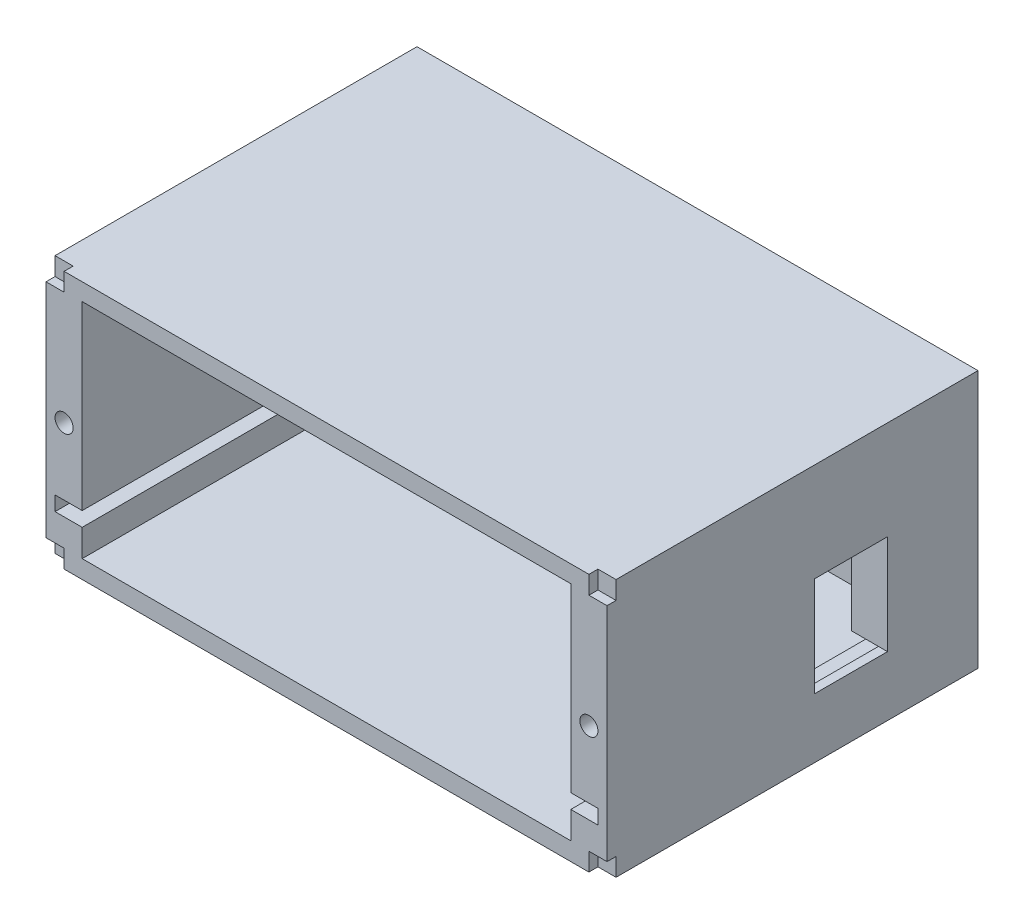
SolidWorks part; units mm, degrees
ref_plane "Front Plane" through (0, 0, 0) normal (0, 0, 1) x (1, 0, 0)
ref_plane "Top Plane" through (0, 0, 0) normal (0, 1, 0) x (1, 0, 0)
ref_plane "Right Plane" through (0, 0, 0) normal (1, 0, 0) x (0, 0, -1)
sketch "Sketch1" plane through (0, 0, 0) normal (0, 0, 1) x (1, 0, 0)
  line L0 (0, 52.9432) -> (0, -40.5494) construction
  line L1 (-31, 0) -> (31, 0)
  line L2 (31, 0) -> (31, 28.5)
  line L3 (31, 28.5) -> (-31, 28.5)
  line L4 (-31, 0) -> (-31, 28.5)
  point P8 (0, 28.5)
  point P9 (0, 0)
extrude "Extrude1" add sketch "Sketch1" against normal blind 41
sketch "Sketch2" plane through (0, 0, 0) normal (0, 0, 1) x (1, 0, 0)
  line L0 (0, 0) -> (0, 28.5) construction
  line L1 (31, 28.5) -> (-31, 28.5) construction
  line L2 (0, 0) -> (0, 2)
  line L3 (-27, 2) -> (27, 2)
  line L4 (27, 2) -> (27, 5)
  line L5 (27, 5) -> (30, 5)
  line L6 (30, 5) -> (30, 6.6)
  line L7 (30, 6.6) -> (27, 6.6)
  line L8 (27, 6.6) -> (27, 26.6)
  line L9 (27, 26.6) -> (-27, 26.6)
  line L10 (-30, 5) -> (-30, 6.6)
  line L11 (-27, 6.6) -> (-27, 26.6)
  line L12 (-30, 6.6) -> (-27, 6.6)
  line L13 (-27, 5) -> (-30, 5)
  line L14 (-27, 2) -> (-27, 5)
  point P17 (0, 26.6)
extrude "Cut-Extrude1" cut sketch "Sketch2" against normal blind 40
sketch "Sketch3" plane through (0, 0, 0) normal (0, 0, 1) x (1, 0, 0)
  circle A0 centre (-29, 14) radius 1
  circle A1 centre (29, 14) radius 1
extrude "Cut-Extrude2" cut sketch "Sketch3" against normal blind 10
sketch "Sketch4" plane through (0, 0, 0) normal (0, 0, 1) x (1, 0, 0)
  line L1 (-31, 28.5) -> (-29, 28.5)
  line L2 (-31, 28.5) -> (-31, 26.5)
  line L3 (-31, 26.5) -> (-29, 26.5)
  line L4 (-29, 28.5) -> (-29, 26.5)
  line L5 (-31, 0) -> (-29, 0)
  line L6 (-31, 0) -> (-31, 2)
  line L7 (-31, 2) -> (-29, 2)
  line L8 (-29, 0) -> (-29, 2)
  line L9 (31, 0) -> (29, 0)
  line L10 (31, 0) -> (31, 2)
  line L11 (31, 2) -> (29, 2)
  line L12 (29, 0) -> (29, 2)
  line L13 (31, 28.5) -> (29, 28.5)
  line L14 (31, 28.5) -> (31, 26.5)
  line L15 (31, 26.5) -> (29, 26.5)
  line L16 (29, 28.5) -> (29, 26.5)
extrude "Cut-Extrude3" cut sketch "Sketch4" against normal blind 1
sketch "Sketch6" plane through (31, 0, 0) normal (1, 0, 0) x (0, 0, -1)
  line L0 (41, 0) -> (41, 6.6)
  line L1 (41, 0) -> (1, 0) construction
  line L2 (41, 0) -> (41, 28.5) construction
  line L4 (31, 6.6) -> (31, 12.6)
  line L5 (31, 12.6) -> (22.9381, 12.6)
  line L6 (22.9381, 12.6) -> (22.9381, 6.6)
  line L7 (22.9381, 6.6) -> (31, 6.6)
extrude "Cut-Extrude5" cut sketch "Sketch6" against normal blind 5.5
chamfer "Chamfer2" distance 5 angle 45 1 edges at (31, 12.6, -26.9691)
sketch "Sketch7" plane through (0, 0, 0) normal (0, -1, 0) x (1, 0, 0)
  line L0 (0, -40.4625) -> (0, 0) construction
  line L1 (0, -20.2312) -> (-31, -20.2312) construction
  line L2 (-31, -41) -> (-31, -1) construction
  circle A0 centre (-27.2035, -4.3241) radius 2
  circle A1 centre (-27.2035, -36.1384) radius 2
  circle A2 centre (27.2035, -36.1384) radius 2
  circle A3 centre (27.2035, -4.3241) radius 2
extrude "Extrude2" add sketch "Sketch7" along normal blind 2
fillet "Fillet3" radius 1.5 4 edges at (27.2035, -2, -38.1384) (27.2035, -2, -2.3241) (-27.2035, -2, -6.3241) (-27.2035, -2, -34.1384)
